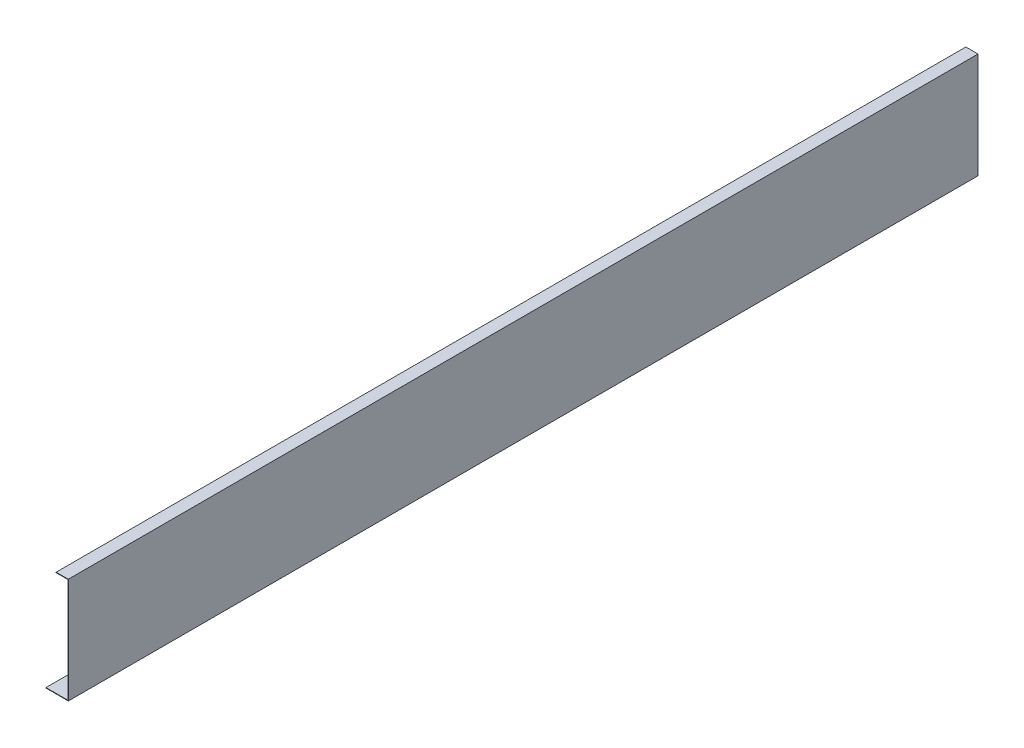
SolidWorks part; units mm, degrees
ref_plane "Plan de face" through (0, 0, 0) normal (0, 0, 1) x (1, 0, 0)
ref_plane "Plan de dessus" through (0, 0, 0) normal (0, 1, 0) x (1, 0, 0)
ref_plane "Plan de droite" through (0, 0, 0) normal (1, 0, 0) x (0, 0, -1)
sketch "Esquisse1" plane through (0, 0, 0) normal (0, 0, 1) x (1, 0, 0)
  line L0 (0, 0) -> (30, 0)
  line L1 (30, 0) -> (30, 130)
  line L2 (30, 130) -> (15, 130)
  line L3 (15, 130) -> (15, 129.35)
  line L4 (15, 129.35) -> (29.35, 129.35)
  line L5 (29.35, 129.35) -> (29.35, 0.65)
  line L6 (29.35, 0.65) -> (0.65, 0.65)
  line L7 (0, 20) -> (0, 0)
  line L9 (0, 20) -> (0.65, 20)
  line L10 (0.65, 20) -> (0.65, 0.65)
  dimension "D1" = 0.65
  dimension "D2" = 0.65
  dimension "D3" = 130
  dimension "D4" = 15
  dimension "D5" = 30
  dimension "D6" = 20
  dimension "D7" = 0.65
  dimension "D8" = 0.65
extrude "Boss.-Extru.2" add sketch "Esquisse1" along normal blind 1121.02
sketch "Esquisse2" plane through (0, 0, 0) normal (0, -1, 0) x (1, 0, 0)
  line L1 (2.5, 1088.52) -> (0, 1088.52)
  line L2 (2.5, 1088.52) -> (2.5, 1121.02)
  line L3 (2.5, 1121.02) -> (0, 1121.02)
  line L4 (0, 1088.52) -> (0, 1121.02)
  line L5 (0, 0) -> (2.5, 0)
  line L6 (0, 0) -> (0, 32.5)
  line L7 (0, 32.5) -> (2.5, 32.5)
  line L8 (2.5, 0) -> (2.5, 32.5)
  dimension "D1" = 2.5
  dimension "D2" = 32.5
  dimension "D3" = 2.5
  dimension "D4" = 32.5
extrude "Enlèv. mat.-Extru.1" cut sketch "Esquisse2" against normal through all
